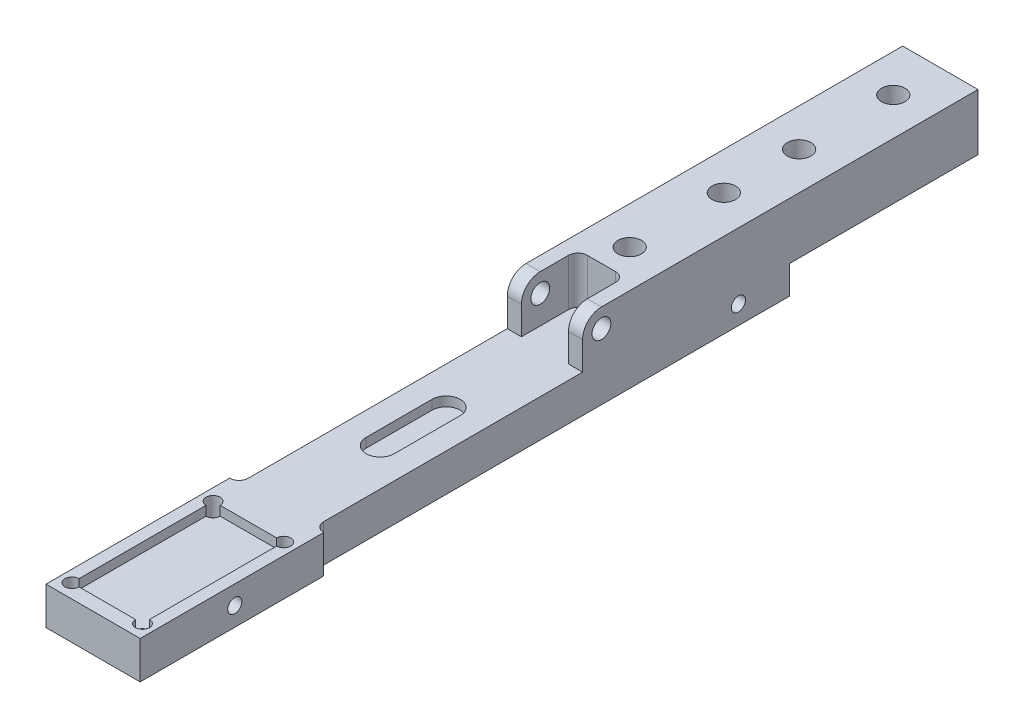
SolidWorks part; units mm, degrees
ref_plane "Front Plane" through (0, 0, 0) normal (0, 0, 1) x (1, 0, 0)
ref_plane "Top Plane" through (0, 0, 0) normal (0, 1, 0) x (1, 0, 0)
ref_plane "Right Plane" through (0, 0, 0) normal (1, 0, 0) x (0, 0, -1)
sketch "Sketch1" plane through (0, 0, 0) normal (1, 0, 0) x (0, 0, -1)
  line L1 (40, -8) -> (-100, -8)
  line L2 (40, -8) -> (40, -14)
  line L3 (40, -14) -> (-100, -14)
  line L4 (-100, -8) -> (-100, -14)
  dimension "D1" = 8
  dimension "D2" = 6
  dimension "D3" = 100
  dimension "D4" = 40
extrude "Boss-Extrude1" add sketch "Sketch1" along normal mid plane 20
sketch "Sketch2" plane through (0, 0, 0) normal (1, 0, 0) x (0, 0, -1)
  line L0 (40, -8) -> (-100, -8) construction
  line L1 (-4, -8) -> (4, -8)
  line L2 (-4, -8) -> (-4, 0)
  line L3 (0, 4) -> (40, 4)
  line L4 (4, -8) -> (40, -8)
  line L5 (40, -8) -> (40, 4)
  circle A0 centre (0, 0) radius 2
  arc A1 (-4, 0) -> (0, 4) centre (0, 0) cw
  dimension "D1" = 4
  dimension "D4" = 8
  dimension "D2" = 12
  dimension "D3" = 4
extrude "Boss-Extrude2" add sketch "Sketch2" along normal mid plane 20
sketch "Sketch6" plane through (0, 0, 4) normal (0, 0, 1) x (1, 0, 0)
  line L0 (10, 4) -> (-10, 4) construction
  line L1 (-10, -8) -> (-8, -8)
  line L2 (-10, -8) -> (-10, 4)
  line L3 (-10, 4) -> (-8, 4)
  line L4 (-8, -8) -> (-8, 4)
  line L5 (0, 0) -> (0, -14.5708) construction
  line L6 (10, -8) -> (8, -8)
  line L7 (8, -8) -> (8, 4)
  line L8 (10, 4) -> (8, 4)
  line L9 (10, -8) -> (10, 4)
  dimension "D1" = 2
extrude "Cut-Extrude3" cut sketch "Sketch6" against normal through all
sketch "Sketch7" plane through (0, 4, 0) normal (0, 1, 0) x (1, 0, 0)
  line L0 (8, -4) -> (-8, -4) construction
  line L1 (-5, -4) -> (5, -4)
  line L2 (-5, -4) -> (-5, 6)
  line L3 (-3, 8) -> (3, 8)
  line L4 (5, -4) -> (5, 6)
  arc A0 (-5, 6) -> (-3, 8) centre (-3, 6) cw
  arc A1 (5, 6) -> (3, 8) centre (3, 6) ccw
  dimension "D3" = 10
  dimension "D4" = 2
  dimension "D1" = 10
  dimension "D2" = 5
extrude "Cut-Extrude4" cut sketch "Sketch7" against normal blind 10
sketch "Sketch8" plane through (0, 0, 4) normal (0, 0, 1) x (1, 0, 0)
  line L0 (8, 0) -> (8, -8) construction
  line L1 (-8, -8) -> (8, -8)
  line L2 (-8, -8) -> (-8, -6)
  line L3 (-8, -6) -> (8, -6)
  line L4 (8, -8) -> (8, -6)
  dimension "D1" = 2
extrude "Boss-Extrude3" add sketch "Sketch8" along normal blind 15
sketch "Sketch9" plane through (0, 0, 19) normal (0, 0, 1) x (1, 0, 0)
  line L0 (-10, -6) -> (10, -6)
  line L1 (-10, -8) -> (10, -8)
  line L6 (-10, -6) -> (-10, -8)
  line L10 (10, -6) -> (10, -8)
  dimension "D1" = 2
extrude "Boss-Extrude4" add sketch "Sketch9" along normal blind 81
sketch "Sketch11" plane through (0, -8, 0) normal (0, 1, 0) x (1, 0, 0)
  line L0 (-10, -59) -> (-10, -61)
  line L1 (10, 40) -> (8, 40)
  line L2 (10, 40) -> (10, -59)
  line L4 (8, 40) -> (8, -59)
  line L5 (-10, 40) -> (-8, 40)
  line L6 (-10, 40) -> (-10, -59)
  line L7 (10, -59) -> (10, -61)
  line L8 (-8, 40) -> (-8, -59)
  arc A0 (-10, -61) -> (-8, -59) centre (-10, -59) ccw
  arc A1 (8, -59) -> (10, -61) centre (10, -59) ccw
  dimension "D1" = 2
  dimension "D2" = 2
  dimension "D3" = 99
  dimension "D4" = 99
extrude "Cut-Extrude6" cut sketch "Sketch11" against normal through all both and the other way through all
sketch "Sketch12" plane through (0, 0, -40) normal (0, 0, -1) x (-1, 0, 0)
  line L1 (-8, 4) -> (-8, -14) construction
  line L2 (8, 4) -> (-8, 4)
  line L3 (8, 4) -> (8, -8)
  line L4 (8, -8) -> (-8, -8)
  line L6 (-8, 4) -> (-8, -8)
  dimension "D1" = 12
extrude "Boss-Extrude5" add sketch "Sketch12" along normal blind 40
sketch "Sketch13" plane through (0, -6, 0) normal (0, 1, 0) x (1, 0, 0)
  line L0 (0, 0) -> (0, -110.9595) construction
  line L1 (10, -100) -> (10, -61) construction
  line L2 (10, -100) -> (-10, -100) construction
  circle A0 centre (7.5, -97) radius 1.5
  circle A1 centre (7.5, -67) radius 1.5
  circle A2 centre (-7.5, -67) radius 1.5
  circle A3 centre (-7.5, -97) radius 1.5
  dimension "D1" = 3
  dimension "D2" = 3
  dimension "D3" = 30
  dimension "D4" = 2.5
  dimension "D5" = 3
  dimension "D6" = 2.5
extrude "Cut-Extrude7" cut sketch "Sketch13" against normal through all
sketch "Sketch14" plane through (0, -6, 0) normal (0, 1, 0) x (1, 0, 0)
  line L1 (-7.5, -67) -> (7.5, -67)
  line L2 (-7.5, -67) -> (-7.5, -97)
  line L3 (-7.5, -97) -> (7.5, -97)
  line L4 (7.5, -67) -> (7.5, -97)
extrude "Cut-Extrude8" cut sketch "Sketch14" against normal blind 2
sketch "Sketch15" plane through (0, -6, 0) normal (0, 1, 0) x (1, 0, 0)
  line L0 (0, 0) -> (0, -108.5535) construction
  line L1 (10, -100) -> (-10, -100) construction
  line L2 (3, -25) -> (3, -39)
  line L3 (-3, -25) -> (-3, -39)
  arc A0 (-3, -39) -> (3, -39) centre (0, -39) ccw
  arc A1 (3, -25) -> (-3, -25) centre (0, -25) ccw
  dimension "D3" = 6
  dimension "D4" = 6
  dimension "D1" = 61
  dimension "D2" = 14
extrude "Cut-Extrude9" cut sketch "Sketch15" against normal blind 2
sketch "Sketch16" plane through (0, -14, 0) normal (0, -1, 0) x (1, 0, 0)
  line L0 (0, 0) -> (0, 106.7596) construction
  line L1 (10, 100) -> (-10, 100) construction
  circle A0 centre (0, -34) radius 2.5
  circle A1 centre (0, -14) radius 2.5
  dimension "D2" = 5
  dimension "D3" = 5
  dimension "D1" = 20
  dimension "D4" = 114
extrude "Cut-Extrude10" cut sketch "Sketch16" against normal through all
sketch "Sketch17" plane through (0, -8, 0) normal (0, -1, 0) x (1, 0, 0)
  line L0 (0, 0) -> (0, -86.9839) construction
  line L1 (8, -80) -> (-8, -80) construction
  circle A0 centre (0, -70) radius 2.5
  circle A1 centre (0, -50) radius 2.5
  dimension "D1" = 5
  dimension "D2" = 5
  dimension "D3" = 10
  dimension "D4" = 20
extrude "Cut-Extrude11" cut sketch "Sketch17" against normal through all
sketch "Sketch18" plane through (8, 0, 0) normal (1, 0, 0) x (0, 0, -1)
  line L0 (40, -14) -> (-59, -14) construction
  circle A0 centre (29.1, -10) radius 1.5
  dimension "D1" = 3
  dimension "D2" = 4
  dimension "D3" = 29.1
extrude "Cut-Extrude12" cut sketch "Sketch18" against normal blind 15
sketch "Sketch19" plane through (10, 0, 0) normal (1, 0, 0) x (0, 0, -1)
  line L0 (-100, -14) -> (-61, -14) construction
  circle A0 centre (-79.9, -10) radius 1.5
  dimension "D2" = 3
  dimension "D1" = 4
  dimension "D3" = 79.9
extrude "Cut-Extrude13" cut sketch "Sketch19" against normal blind 15
